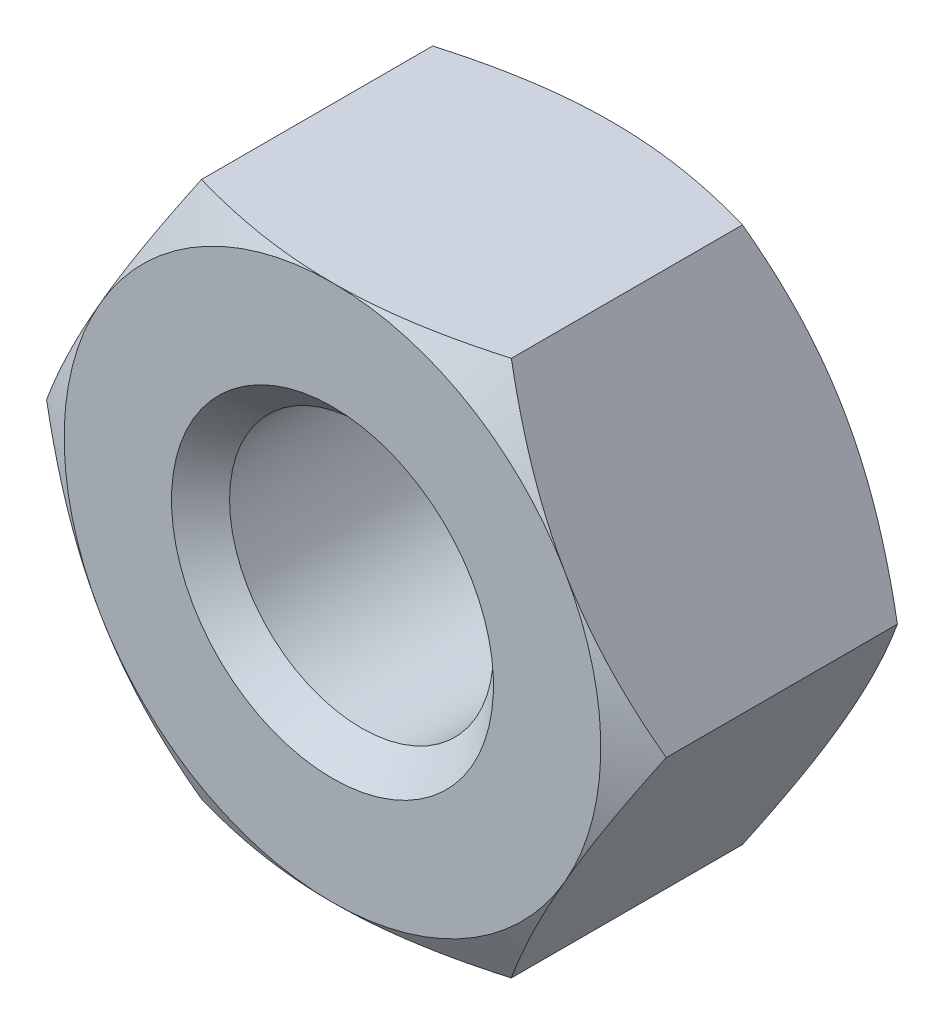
SolidWorks part; units mm, degrees
ref_plane "Plan de face" through (0, 0, 0) normal (0, 0, 1) x (1, 0, 0)
ref_plane "Plan de dessus" through (0, 0, 0) normal (0, 1, 0) x (1, 0, 0)
ref_plane "Plan de droite" through (0, 0, 0) normal (1, 0, 0) x (0, 0, -1)
imported_body "Importée3"
hole_wizard "Perçage1" positions "Esquisse2" profile "Esquisse1" legacy
sketch "Esquisse2" plane through (0, 0, 0) normal (0, 0, -1) x (-1, 0, 0)
  point P0 (0, 0)
sketch "Esquisse1" plane through (0, 0, 0) normal (1, 0, 0) x (0, 1, 0)
  line L0 (0, 0) -> (0, 5.2)
  line L1 (0, 5.2) -> (2.4588, 5.2)
  line L2 (2.4588, 5.2) -> (2.4588, 0)
  line L3 (2.4588, 0) -> (0, 0)
  line L4 (0, 110) -> (0, -10) construction
  dimension "Diamètre" = 4.9175
  dimension "Profondeur" = 5.2
chamfer "Chanfrein1" distance 0.5413 angle 45 2 edges at (0, 2.4588, 5.2) (0, 2.4588, 0)
